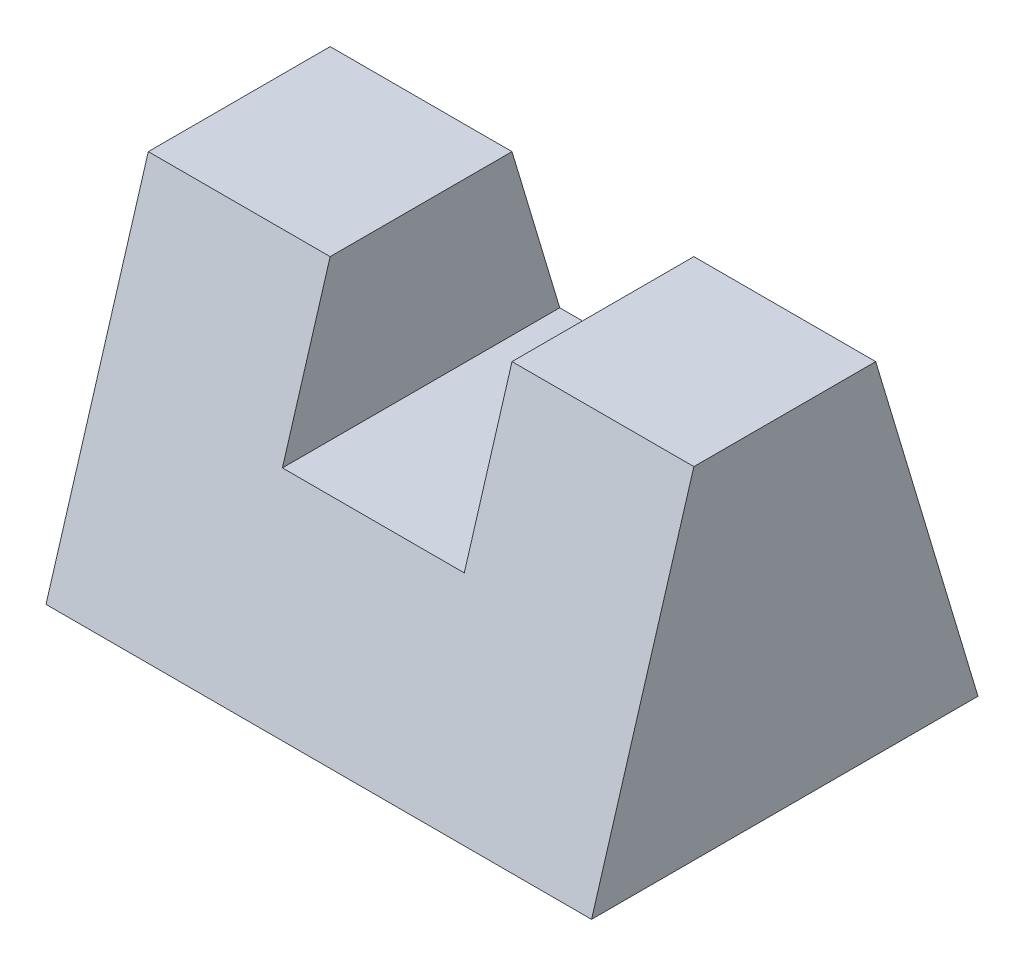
SolidWorks part; units mm, degrees
ref_plane "前视基准面" through (0, 0, 0) normal (0, 0, 1) x (1, 0, 0)
ref_plane "上视基准面" through (0, 0, 0) normal (0, 1, 0) x (1, 0, 0)
ref_plane "右视基准面" through (0, 0, 0) normal (1, 0, 0) x (0, 0, -1)
sketch "草图1" plane through (0, 0, 0) normal (1, 0, 0) x (0, 0, -1)
  line L0 (-42.5, 0) -> (42.5, 0)
  line L1 (42.5, 0) -> (20, 75)
  line L2 (20, 75) -> (-20, 75)
  line L3 (-20, 75) -> (-42.5, 0)
  line L4 (0, -59.4126) -> (0, 96.3448) construction
  dimension "D1" = 75
  dimension "D2" = 40
  dimension "D3" = 85
extrude "拉伸1" add sketch "草图1" along normal blind 120
sketch "草图2" plane through (0, 75, 0) normal (0, 1, 0) x (1, 0, 0)
  line L1 (40, 36.9732) -> (80, 36.9732)
  line L2 (40, 36.9732) -> (40, -39.8467)
  line L3 (40, -39.8467) -> (80, -39.8467)
  line L4 (80, 36.9732) -> (80, -39.8467)
  line L5 (120, 42.5) -> (120, 20) construction
  dimension "D1" = 40
  dimension "D2" = 40
extrude "切除-拉伸1" cut sketch "草图2" against normal blind 35
